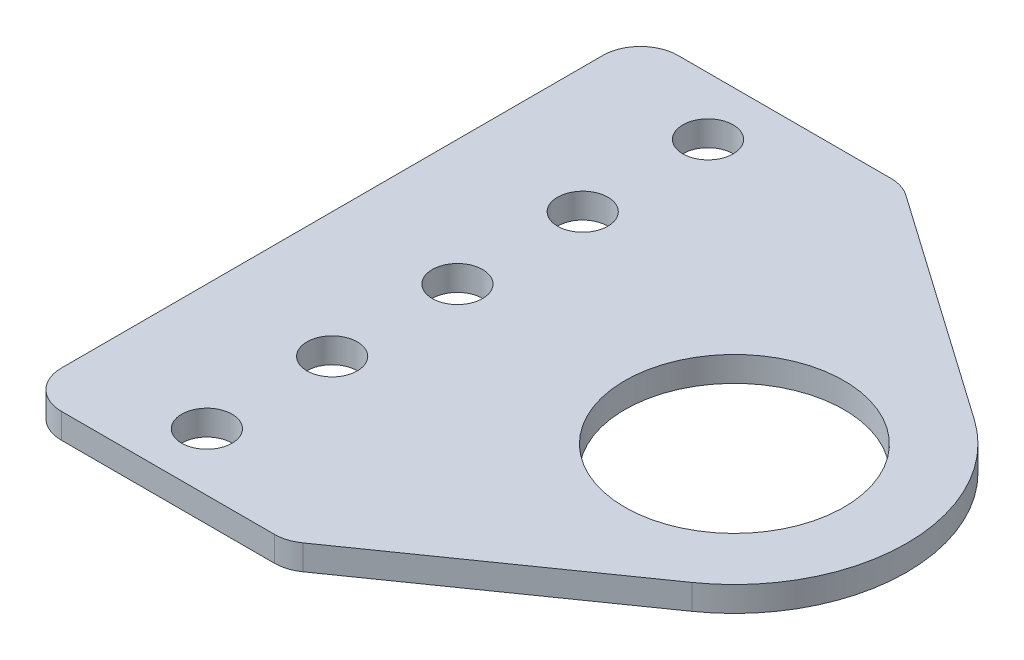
SolidWorks part; units mm, degrees
ref_plane "Front Plane" through (0, 0, 0) normal (0, 0, 1) x (1, 0, 0)
ref_plane "Top Plane" through (0, 0, 0) normal (0, 1, 0) x (1, 0, 0)
ref_plane "Right Plane" through (0, 0, 0) normal (1, 0, 0) x (0, 0, -1)
sketch "Sketch1" plane through (0, 0, 0) normal (0, 1, 0) x (1, 0, 0)
  line L0 (-40.775, -27.44) -> (-40.775, 27.44)
  line L1 (-15.375, -31.25) -> (-36.965, -31.25)
  line L2 (-36.965, 31.25) -> (-15.375, 31.25)
  line L3 (-13.189, -30.5605) -> (10.0193, -14.3022)
  line L4 (10.0193, 14.3022) -> (-13.189, 30.5605)
  line L5 (-15.375, 31.25) -> (-15.375, -31.25) construction
  circle A0 centre (0, 0) radius 11.1125
  circle A1 centre (-28.075, 25.4) radius 2.5527
  circle A2 centre (-28.075, 12.7) radius 2.5527
  circle A3 centre (-28.075, 0) radius 2.5527
  circle A4 centre (-28.075, -12.7) radius 2.5527
  circle A5 centre (-28.075, -25.4) radius 2.5527
  arc A7 (10.0193, -14.3022) -> (10.0193, 14.3022) centre (0, 0) ccw
  arc A9 (-36.965, 31.25) -> (-40.775, 27.44) centre (-36.965, 27.44) ccw
  arc A10 (-40.775, -27.44) -> (-36.965, -31.25) centre (-36.965, -27.44) ccw
  arc A13 (-15.375, -31.25) -> (-13.189, -30.5605) centre (-15.375, -27.44) ccw
  arc A14 (-15.375, 31.25) -> (-13.189, 30.5605) centre (-15.375, 27.44) cw
  point P12 (-14.1732, -31.25)
  point P23 (-14.1732, 31.25)
  dimension "D1" = 5.1054
  dimension "D2" = 22.225
  dimension "D3" = 17.4625
  dimension "D4" = 3.81
  dimension "D9" = 3.81
  dimension "D10" = 12.7
  dimension "D11" = 12.7
  dimension "D12" = 12.7
  dimension "D5" = 12.7
  dimension "D6" = 31.25
  dimension "D7" = 31.25
  dimension "D8" = 40.775
  dimension "D13" = 12.7
  dimension "D14" = 25.4
extrude "Boss-Extrude1" add sketch "Sketch1" along normal blind 2.54
